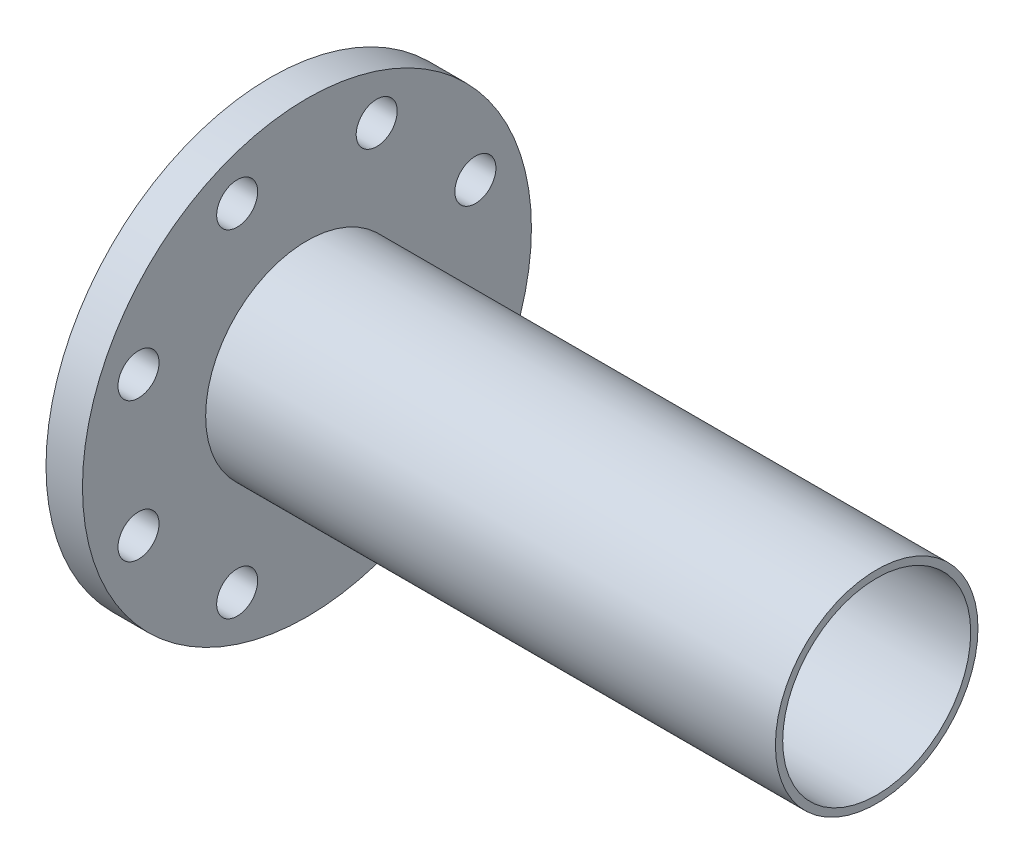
SolidWorks part; units mm, degrees
ref_plane "Plan de face" through (0, 0, 0) normal (0, 0, 1) x (1, 0, 0)
ref_plane "Plan de dessus" through (0, 0, 0) normal (0, 1, 0) x (1, 0, 0)
ref_plane "Plan de droite" through (0, 0, 0) normal (1, 0, 0) x (0, 0, -1)
sketch "Esquisse2" plane through (0, 0, 0) normal (1, 0, 0) x (0, 0, -1)
  circle A1 centre (0, -400) radius 40
  circle A3 centre (0, -400) radius 98.5
  circle A5 centre (-30.6147, -326.0896) radius 9
  circle A7 centre (30.6147, -326.0896) radius 9
  circle A9 centre (73.9104, -369.3853) radius 9
  circle A11 centre (73.9104, -430.6147) radius 9
  circle A13 centre (30.6147, -473.9104) radius 9
  circle A15 centre (-30.6147, -473.9104) radius 9
  circle A17 centre (-73.9104, -430.6147) radius 9
  circle A19 centre (-73.9104, -369.3853) radius 9
base flange "Tôle de base pliée1" sketch "Esquisse2" thickness 16 reverse thickness direction no parameters "D1"=10
sketch "Esquisse7" plane through (0, 0, 0) normal (0, 0, 1) x (1, 0, 0)
  line L0 (0, -400) -> (250, -400)
  line L1 (0, -498.5) -> (0, -301.5) construction
  dimension "D1" = 250
other "Tube circulaire 88.9X3.2(1)"
ref_plane "Plan4" through (0, -400, 0) normal (1, 0, 0) x (0, 1, 0)
sketch "Esquisse1" plane through (0, -400, 0) normal (1, 0, 0) x (0, 1, 0)
  circle A0 centre (0, 0) radius 44.45
  circle A1 centre (0, 0) radius 41.25
  point P4 (0, 0)
  dimension "D1" = 88.9
  dimension "D2" = 3.2
sketch "Lignes de pliage1" [suppressed] plane through (0, 0, 0) normal (0, 1, 0) x (1, 0, 0)
sketch "Cube de visualisation1" [suppressed] plane through (0, 0, 0) normal (0, 1, 0) x (1, 0, 0)
sheet metal parameters "Tôlerie1" thickness 16 parameters "D1"=10
flat pattern "Etat déplié1"
sketch "Lignes de pliage2" plane through (0, 0, 0) normal (0, 1, 0) x (1, 0, 0)
sketch3d "Cube de visualisation2" [suppressed]
  line L0 (98.3482, -98.6515, 0) -> (-98.6514, -98.3483, 0) construction
  line L1 (98.6514, 98.3482, 0) -> (-98.3482, 98.6514, 0) construction
  line L2 (98.3482, -98.6515, 0) -> (98.6514, 98.3482, 0) construction
  line L3 (-98.6514, -98.3483, 0) -> (-98.3482, 98.6514, 0) construction
